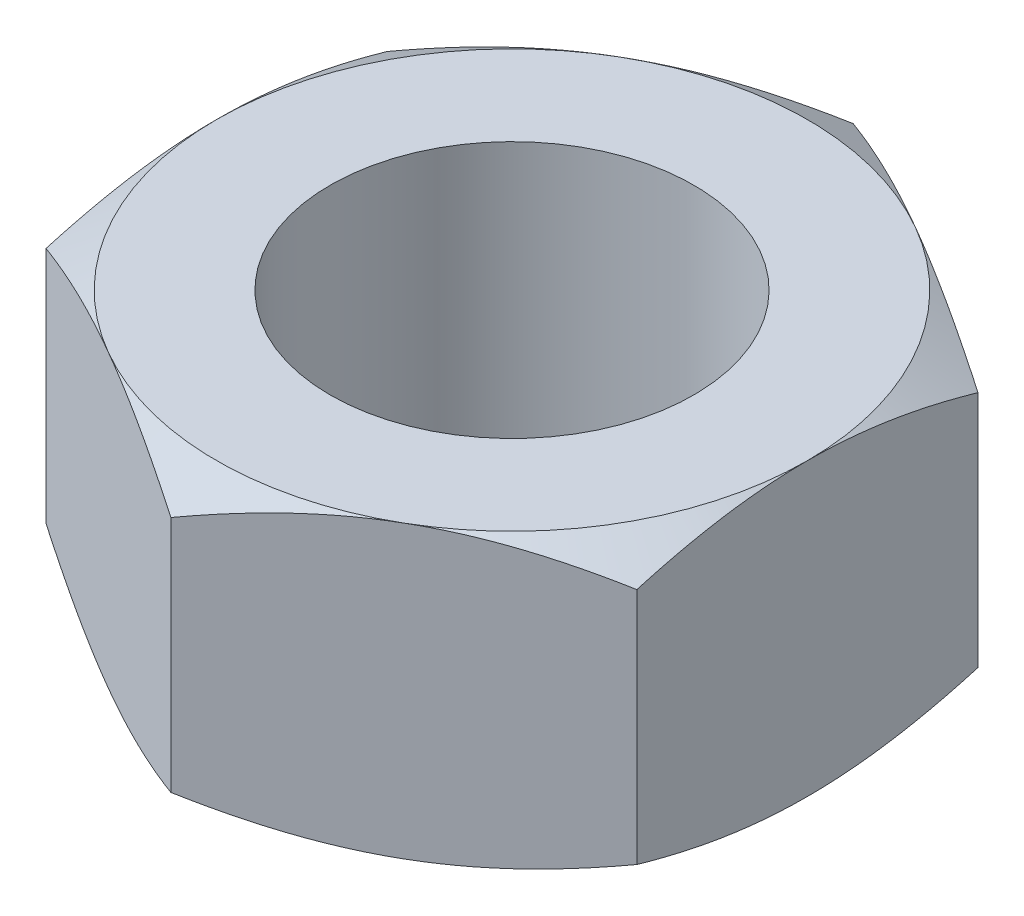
SolidWorks part; units mm, degrees
ref_plane "Plan1" through (0, 0, 0) normal (0, 0, 1) x (1, 0, 0)
ref_plane "Plan2" through (0, 0, 0) normal (0, 1, 0) x (1, 0, 0)
ref_plane "Plan3" through (0, 0, 0) normal (1, 0, 0) x (0, 0, -1)
sketch "Esquisse1" plane through (0, 0, 0) normal (0, 0, 1) x (1, 0, 0)
  line L0 (-6.5, 6.4) -> (0, 6.4)
  line L1 (0, 6.4) -> (0, 0)
  line L2 (0, 0) -> (-6.5, 0)
  line L3 (-6.5, 0) -> (-11, 2.5981)
  line L4 (-11, 2.5981) -> (-11, 3.8019)
  line L5 (-11, 3.8019) -> (-6.5, 6.4)
  line L6 (0, 10) -> (0, -20) construction
  dimension "D1" = 6.4
  dimension "D2" = 30
  dimension "D3" = 30
  dimension "D4" = 11
  dimension "D5" = 6.5
  dimension "D6" = 6.5
revolve "Base-Révolution" add sketch "Esquisse1" angle 360 about L6
sketch "Esquisse2" plane through (0, 6.4, 0) normal (0, 1, 0) x (-1, 0, 0)
  line L1 (6.5, -11) -> (-6.5, -11)
  line L2 (6.5, -11) -> (6.5, 11)
  line L3 (6.5, 11) -> (-6.5, 11)
  line L4 (-6.5, -11) -> (-6.5, 11)
  circle A0 centre (0, 0) radius 6.5 construction
  circle A1 centre (0, 0) radius 11 construction
extrude "Enlèv. mat.-Extru.1" cut sketch "Esquisse2" against normal through all flip side to cut
pattern_circular "Répétition circulaire1" count 3 every 60 about axis through (0, 10, 0) along (0, -1, 0)
sketch "Esquisse3" plane through (0, 6.4, 0) normal (0, 1, 0) x (-1, 0, 0)
  circle A0 centre (0, 0) radius 4
  dimension "D1" = 8
extrude "Enlèv. mat.-Extru.2" cut sketch "Esquisse3" against normal through all
